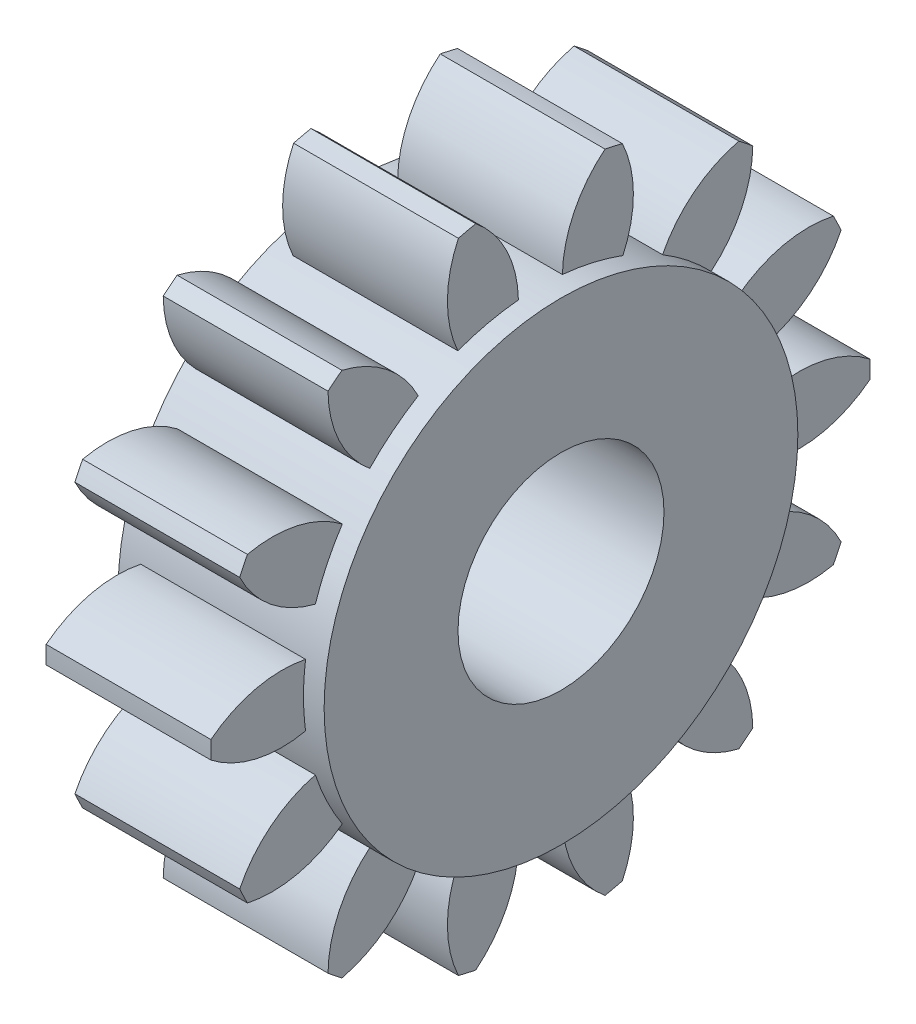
SolidWorks part; units mm, degrees
other "<Metric - Spur gear 2M 14T 20PA 8FW ---S14B70H10L10N>-<Bore>"
ref_plane "Front Plane" through (0, 0, 0) normal (0, 0, 1) x (1, 0, 0)
ref_plane "Top Plane" through (0, 0, 0) normal (0, 1, 0) x (1, 0, 0)
ref_plane "Right Plane" through (0, 0, 0) normal (1, 0, 0) x (0, 0, -1)
ref_plane "Plane1-Metric - Spur gear 2M 14T 20PA 8FW ---S14B70H10L10N" through (0, 0, 0) normal (0, 0, 1) x (1, 0, 0)
ref_plane "Plane2-Metric - Spur gear 2M 14T 20PA 8FW ---S14B70H10L10N" through (0, 0, 0) normal (0, 1, 0) x (1, 0, 0)
ref_plane "Plane3-Metric - Spur gear 2M 14T 20PA 8FW ---S14B70H10L10N" through (0, 0, 0) normal (1, 0, 0) x (0, 0, -1)
sketch "HoldingSke-Metric - Spur gear 2M 14T 20PA 8FW ---S14B70H10L10N" plane through (0, 0, 0) normal (0, 1, 0) x (1, 0, 0)
  line L0 (0, 0) -> (0.4851, -0.121)
  line L1 (-15, 0) -> (100, 0) construction
  line L2 (0, 0) -> (-2.1039, 2.3779)
  line L3 (0, 0) -> (-11.863, 4.5341)
  line L4 (0, 0) -> (8.3795, 2.0892)
  line L5 (0, 0) -> (-9.3695, -3.4946)
  line L6 (0, 0) -> (-6.6317, -4.4744)
  line L7 (-2.1039, 2.3779) -> (0.0486, 12.1435)
  line L8 (-76.2, 54.61) -> (-74.4, 54.61)
  line L9 (-71.009, 38.7566) -> (-53.1078, 45.2721)
  line L10 (-76.2, 71.12) -> (104.1128, 71.12)
  line L11 (0, 0) -> (-8, 0)
  line L12 (-76.2, 101.6) -> (-76.133, 101.6)
  line L13 (24.9733, 27.94) -> (52.9518, 28.4284)
  line L14 (24.9733, 27.94) -> (24.9743, 27.94)
  line L15 (24.9733, 27.94) -> (100.4006, 29.5858)
  line L16 (-63.627, -2) -> (-12.827, -2)
  circle A0 centre (0, 0) radius 5
  circle A1 centre (0, 0) radius 11.499
  circle A2 centre (0, 0) radius 35
  circle A3 centre (0, 0) radius 5
  dimension "MHD" = 22.998
  dimension "Hub_dia" = 70
  dimension "Bore" = 10
  dimension "MBD" = 10
  dimension "Num_teeth" = 14
  dimension "Pitch_radius" = 180.3128
  dimension "Pitch" = 0.5
  dimension "Width" = 8
  dimension "Overall_len" = 10
  dimension "Show_teeth" = 14
  dimension "Thickness" = 8
  dimension "OAL" = 10.0001
  dimension "T_dim" = 1.8
  dimension "Ap" = 20
  dimension "H" = 19.05
  dimension "Backlash" = 0.067
  dimension "Addendum_fac" = 1
  dimension "Dedendum_fac" = 1.25
  dimension "Clearance_fac" = 0.25
  dimension "Dedendum_add" = 0.001
  dimension "Module" = 2
sketch "BasProSke-Metric - Spur gear 2M 14T 20PA 8FW ---S14B70H10L10N" plane through (0, 0, 0) normal (0, 1, 0) x (1, 0, 0)
  line L0 (-10, 0) -> (60, 0) construction
  line L1 (0, 0) -> (0, 16)
  line L2 (0, 0) -> (8, 0)
  line L3 (8, 0) -> (8, 16)
  line L4 (8, 16) -> (0, 16)
  dimension "Diameter" = 32
  dimension "Thickness" = 8
sketch "TooCutSke-Metric - Spur gear 2M 14T 20PA 8FW ---S14B70H10L10N" plane through (0, 0, 0) normal (1, 0, 0) x (0, 0, -1)
  line L1 (0, 0) -> (0, 107) construction
  line L2 (0, 0) -> (-1.6846, 13.8983) construction
  line L3 (0, 0) -> (-6.1971, 27.1511) construction
  line L4 (-1.6846, 13.8983) -> (-3.0985, 13.5756) construction
  arc A0 (1.0679, 11.4493) -> (-1.0679, 11.4493) centre (0, 0) ccw
  arc A1 (3.1634, 15.7101) -> (-3.1634, 15.7101) centre (0, 0) ccw
  circle A2 centre (0, 0) radius 14 construction
  circle A3 centre (0, 0) radius 13.1557 construction
  arc A4 (-1.0679, 11.4493) -> (-3.1634, 15.7101) centre (-6.6668, 11.3413) ccw
  arc A5 (3.1634, 15.7101) -> (1.0679, 11.4493) centre (6.6668, 11.3413) ccw
  dimension "Root_dia" = 22.998
  dimension "Overcut_dia" = 32.0508
  dimension "Pitch_dia" = 28
  dimension "Base_dia" = 26.3114
  dimension "Flank_rad" = 5.6
  dimension "Half_ang" = 12.857
  dimension "Half_CT" = 1.4503
sketch "HubNeaOneSke-Metric - Spur gear 2M 14T 20PA 8FW ---S14B70H10L10N" plane through (0, 0, 0) normal (-1, 0, 0) x (0, 0, 1)
  circle A0 centre (0, 0) radius 11.499
  dimension "Diameter" = 22.998
sketch "HubNeaBotSke-Metric - Spur gear 2M 14T 20PA 8FW ---S14B70H10L10N" plane through (0, 0, 0) normal (-1, 0, 0) x (0, 0, 1)
  circle A0 centre (0, 0) radius 11.499
  dimension "Diameter" = 22.998
ref_plane "FarPln-Metric - Spur gear 2M 14T 20PA 8FW ---S14B70H10L10N" through (8, 0, 0) normal (1, 0, 0) x (0, 0, -1)
sketch "HubFarSke-Metric - Spur gear 2M 14T 20PA 8FW ---S14B70H10L10N" plane through (8, 0, 0) normal (1, 0, 0) x (0, 0, -1)
  circle A0 centre (0, 0) radius 11.499
  dimension "Diameter" = 22.998
sketch "BorSke-Metric - Spur gear 2M 14T 20PA 8FW ---S14B70H10L10N" plane through (0, 0, 0) normal (1, 0, 0) x (0, 0, -1)
  circle A0 centre (0, 0) radius 5
  dimension "Diameter" = 10
sketch "KeySke-Metric - Spur gear 2M 14T 20PA 8FW ---S14B70H10L10N" plane through (0, 0, 0) normal (1, 0, 0) x (0, 0, -1)
  line L0 (-2, 0) -> (-2, 6.8)
  line L1 (-2, 6.8) -> (2, 6.8)
  line L2 (2, 6.8) -> (2, 0)
  line L3 (0, 0) -> (0, 34) construction
  line L4 (-2, 0) -> (2, 0)
  dimension "Offset" = 6.8
  dimension "Width" = 4
inserted part "Metric - Spur gear 2M 14T 20PA 8FW ---S14B70H10L10N"
